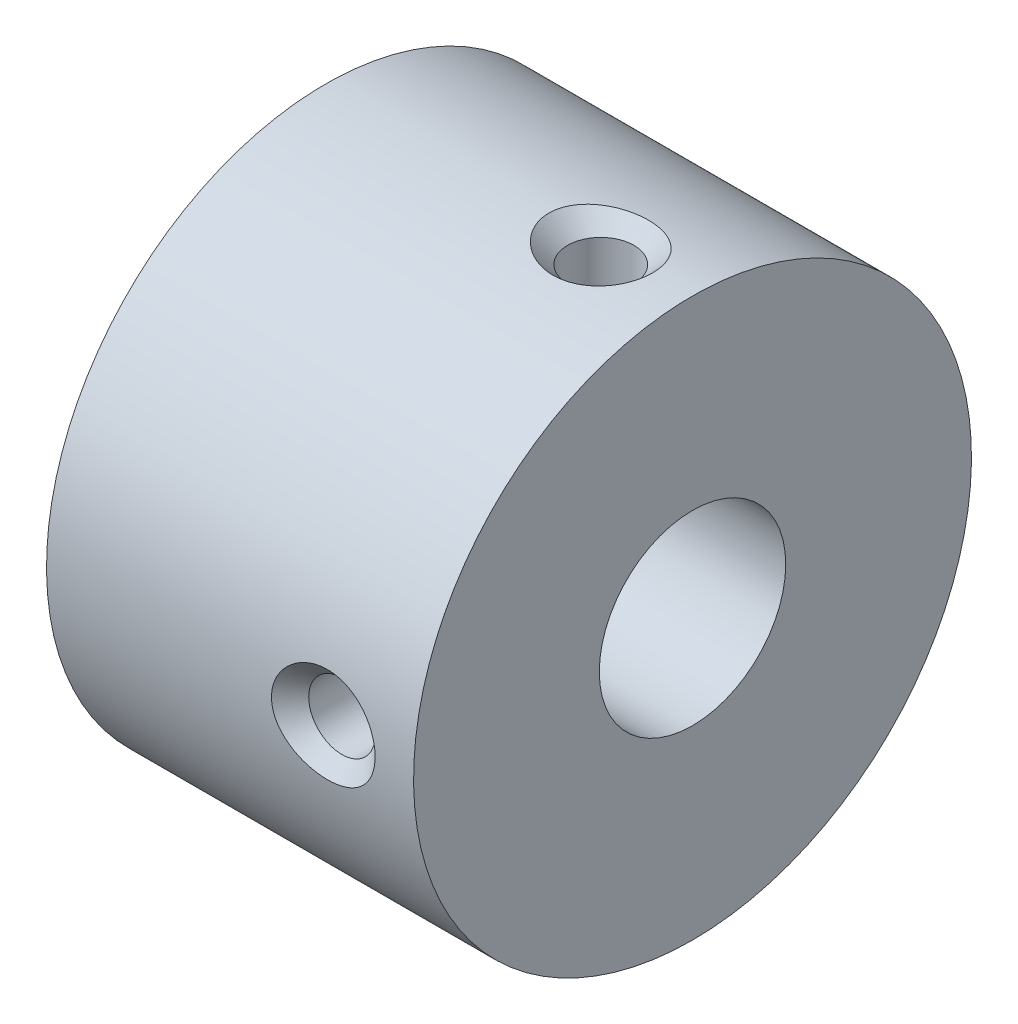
SolidWorks part; units mm, degrees
ref_plane "Front Plane" through (0, 0, 0) normal (0, 0, 1) x (1, 0, 0)
ref_plane "Top Plane" through (0, 0, 0) normal (0, 1, 0) x (1, 0, 0)
ref_plane "Right Plane" through (0, 0, 0) normal (1, 0, 0) x (0, 0, -1)
sketch "Sketch1" plane through (0, 0, 0) normal (0, 0, 1) x (1, 0, 0)
  line L0 (-27.9822, 0) -> (27.9822, 0) construction
  line L1 (-6.25, 9.5) -> (6.25, 9.5)
  line L2 (-6.25, 9.5) -> (-6.25, 0)
  line L3 (6.25, 9.5) -> (6.25, 0)
  line L4 (-6.25, 0) -> (6.25, 0)
  point P3 (0, 0)
  point P6 (0, 9.5)
  dimension "D1" = 9.5
  dimension "D2" = 12.5
revolve "Revolve1" add sketch "Sketch1" angle 360 about L0
hole_wizard "1/4 (0.25) Diameter Hole1" positions "Sketch3" profile "Sketch2" hole size "1/4" standard "Ansi Inch"
sketch "Sketch3" plane through (6.25, 0, 0) normal (1, 0, 0) x (0, 0, -1)
  point P0 (0, 0)
sketch "Sketch2" plane through (6.25, 0, 0) normal (0, 1, 0) x (0, 0, -1)
  line L0 (0, 0) -> (0, 12.5)
  line L1 (0, 12.5) -> (3.175, 12.5)
  line L2 (3.175, 12.5) -> (3.175, 0)
  line L5 (3.175, 0) -> (0, 0)
  line L11 (0, -6.35) -> (0, 107.95) construction
  dimension "Thru Hole Dia." = 6.35
  dimension "Thru Hole Depth" = 12.5
hole_wizard "#4-40 Tapped Hole3" positions "Sketch10" profile "Sketch9" tap size "#4-40" standard "Ansi Inch"
sketch "Sketch10" plane through (0, 0, 0) normal (0, 1, 0) x (1, 0, 0)
  point P3 (3.125, 0)
sketch "Sketch9" plane through (3.125, 0, 0) normal (1, 0, 0) x (0, 0, -1)
  line L0 (0, 0) -> (0, 9.5)
  line L1 (0, 9.5) -> (1.7653, 9.5)
  line L2 (1.1303, 8.865) -> (1.1303, 0)
  line L5 (1.1303, 0) -> (0, 0)
  line L7 (1.7653, 9.5) -> (1.1303, 8.865)
  line L8 (-1.7653, 9.5) -> (-1.1303, 8.865) construction
  line L11 (0, -6.35) -> (0, 107.95) construction
  dimension "Thru Tap Drill Dia." = 2.2606
  dimension "Thru Tap Drill Depth" = 9.5
  dimension "Far C'Sink Dia." = 3.5306
  dimension "Far C'Sink Angle" = 90
hole_wizard "#4-40 Tapped Hole4" positions "Sketch12" profile "Sketch13" tap size "#4-40" standard "Ansi Inch"
sketch "Sketch12" plane through (0, 0, 0) normal (0, 0, 1) x (1, 0, 0)
  point P1 (3.175, 0)
sketch "Sketch13" plane through (3.175, 0, 0) normal (1, 0, 0) x (0, 1, 0)
  line L0 (0, 0) -> (0, 9.5)
  line L1 (0, 9.5) -> (1.7653, 9.5)
  line L2 (1.1303, 8.865) -> (1.1303, 0)
  line L5 (1.1303, 0) -> (0, 0)
  line L7 (1.7653, 9.5) -> (1.1303, 8.865)
  line L8 (-1.7653, 9.5) -> (-1.1303, 8.865) construction
  line L11 (0, -6.35) -> (0, 107.95) construction
  dimension "Thru Tap Drill Dia." = 2.2606
  dimension "Thru Tap Drill Depth" = 9.5
  dimension "Far C'Sink Dia." = 3.5306
  dimension "Far C'Sink Angle" = 90
